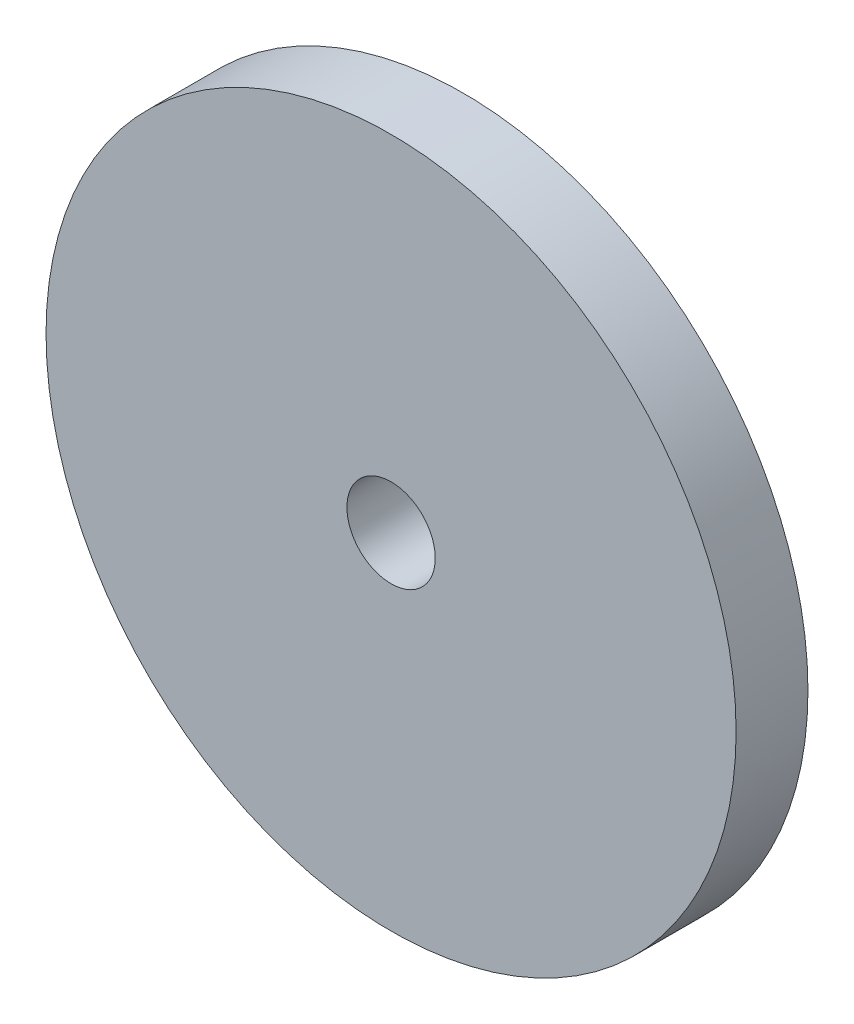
SolidWorks part; units mm, degrees
ref_plane "Front Plane" through (0, 0, 0) normal (0, 0, 1) x (1, 0, 0)
ref_plane "Top Plane" through (0, 0, 0) normal (0, 1, 0) x (1, 0, 0)
ref_plane "Right Plane" through (0, 0, 0) normal (1, 0, 0) x (0, 0, -1)
sketch "Sketch1" plane through (0, 0, 0) normal (0, 0, 1) x (1, 0, 0)
  circle A0 centre (0, 0) radius 3.2
  circle A1 centre (0, 0) radius 25
  dimension "D1" = 6.4
  dimension "D2" = 50
extrude "Boss-Extrude1" add sketch "Sketch1" along normal blind 5.2059
